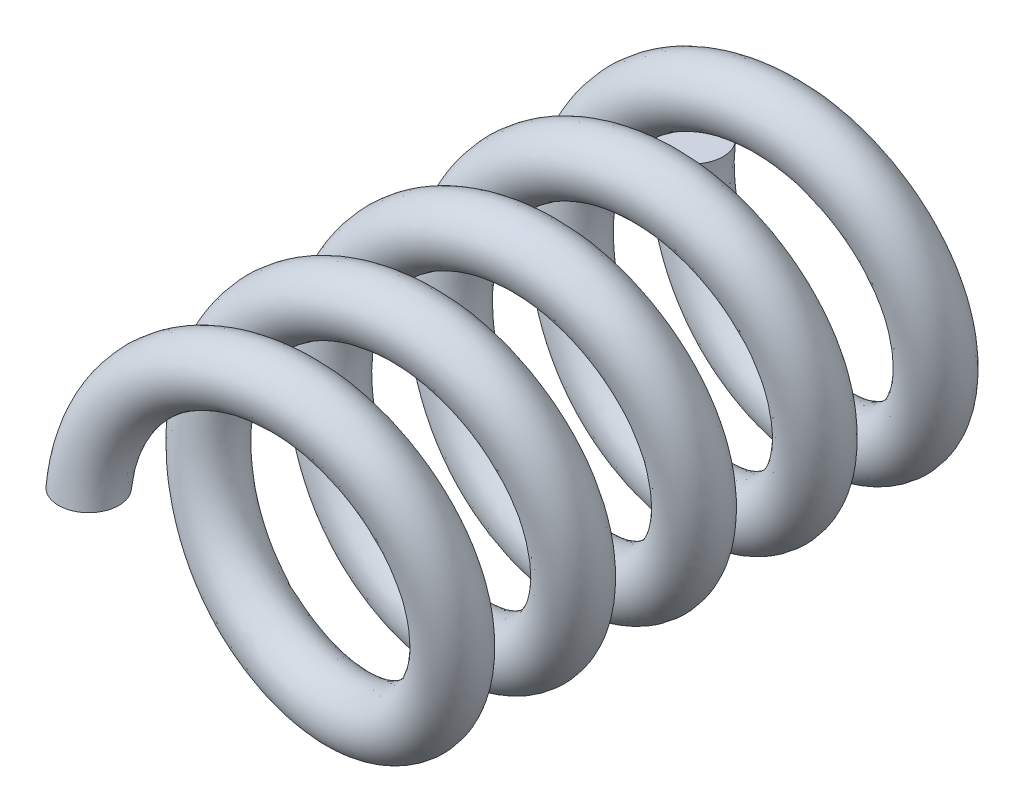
SolidWorks part; units mm, degrees
ref_plane "Front Plane" through (0, 0, 0) normal (0, 0, 1) x (1, 0, 0)
ref_plane "Top Plane" through (0, 0, 0) normal (0, 1, 0) x (1, 0, 0)
ref_plane "Right Plane" through (0, 0, 0) normal (1, 0, 0) x (0, 0, -1)
sketch "Sketch1" plane through (0, 0, 0) normal (0, 1, 0) x (1, 0, 0)
  line L0 (0, 0) -> (1.27, 0) construction
  line L1 (1.27, 0) -> (1.27, 10.16)
  circle A0 centre (0, 0) radius 0.254
sketch "Sketch2" plane through (0, 0, 0) normal (0, 1, 0) x (1, 0, 0)
  line L0 (1.27, 0) -> (1.27, 10.16) construction
  line L1 (1.27, 0) -> (1.27, 5.08)
sweep "Sweep1" add profiles "Sketch1" path "Sketch2" parameters "D1"=1800
